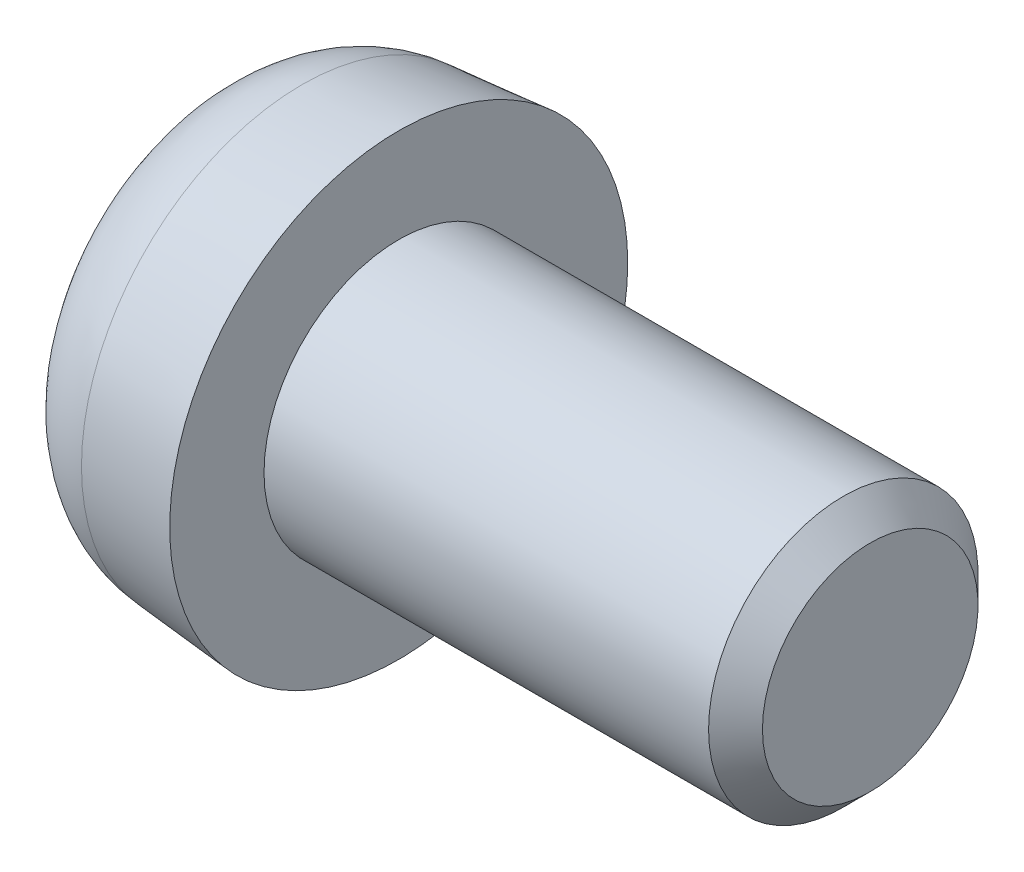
SolidWorks part; units mm, degrees
ref_plane "Face" through (0, 0, 0) normal (0, 0, 1) x (1, 0, 0)
ref_plane "Dessus" through (0, 0, 0) normal (0, 1, 0) x (1, 0, 0)
ref_plane "Droite" through (0, 0, 0) normal (1, 0, 0) x (0, 0, -1)
imported_body "Importée1"
sketch "Esquisse1" plane through (30, 0, 0) normal (1, 0, 0) x (0, 0, -1)
  circle A0 centre (0, 0) radius 1 construction
  circle A1 centre (0, 0) radius 1
extrude "Enlèv. mat.-Extru.1" cut sketch "Esquisse1" against normal offset from surface (26.5 mm away) 3.5
chamfer "Chanfrein1" distance 0.2 angle 45
